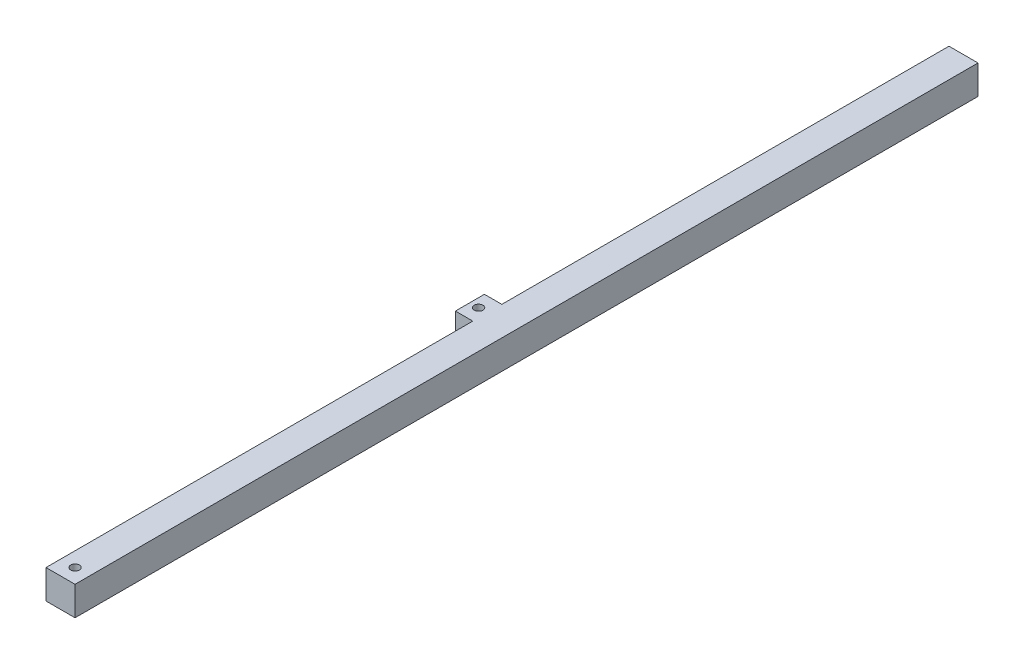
SolidWorks part; units mm, degrees
ref_plane "Plan1" through (0, 0, 0) normal (0, 0, 1) x (1, 0, 0)
ref_plane "Plan2" through (0, 0, 0) normal (0, 1, 0) x (1, 0, 0)
ref_plane "Plan3" through (0, 0, 0) normal (1, 0, 0) x (0, 0, -1)
sketch "Esquisse1" plane through (0, 0, 0) normal (0, 0, 1) x (1, 0, 0)
  line L0 (0, 0) -> (0, 5)
  line L1 (0, 5) -> (5, 5)
  line L2 (5, 5) -> (5, 0)
  line L3 (0, 0) -> (1, 0)
  line L4 (1, 0) -> (1, 4)
  line L5 (1, 4) -> (4, 4)
  line L6 (4, 4) -> (4, 0)
  line L7 (4, 0) -> (5, 0)
  dimension "D1" = 5
  dimension "D2" = 5
  dimension "D3" = 1
  dimension "D4" = 1
  dimension "D5" = 1
extrude "Base-Extrusion" add sketch "Esquisse1" along normal blind 150.5
sketch "Esquisse2" plane through (0, 0, 150.5) normal (0, 0, 1) x (1, 0, 0)
  line L1 (0, 5) -> (5, 5)
  line L2 (0, 5) -> (0, 0)
  line L3 (0, 0) -> (5, 0)
  line L4 (5, 5) -> (5, 0)
extrude "Boss.-Extru.1" add sketch "Esquisse2" along normal blind 5
sketch "Esquisse3" plane through (0, 0, 0) normal (0, -1, 0) x (1, 0, 0)
  line L0 (0, 155.5) -> (0, 0) construction
  line L1 (0, 155.5) -> (5, 155.5) construction
  circle A0 centre (2.5, 153) radius 0.75
  dimension "D3" = 1.5
  dimension "D1" = 2.5
  dimension "D2" = 2.5
extrude "Enlèv. mat.-Extru.1" cut sketch "Esquisse3" against normal through all
sketch "Esquisse4" plane through (0, 0, 0) normal (-1, 0, 0) x (0, 0, 1)
  line L0 (155.5, 5) -> (0, 5) construction
  line L1 (82, 5) -> (77, 5)
  line L2 (82, 5) -> (82, 0)
  line L3 (82, 0) -> (77, 0)
  line L4 (77, 5) -> (77, 0)
  dimension "D1" = 5
  dimension "D2" = 77
extrude "Boss.-Extru.2" add sketch "Esquisse4" along normal blind 3
sketch "Esquisse5" plane through (0, 0, 0) normal (0, -1, 0) x (1, 0, 0)
  line L0 (-3, 82) -> (0, 82) construction
  line L1 (-3, 77) -> (-3, 82) construction
  circle A0 centre (-1.5, 79.5) radius 0.75
  dimension "D3" = 1.5
  dimension "D1" = 2.5
  dimension "D2" = 1.5
extrude "Enlèv. mat.-Extru.2" cut sketch "Esquisse5" against normal through all
